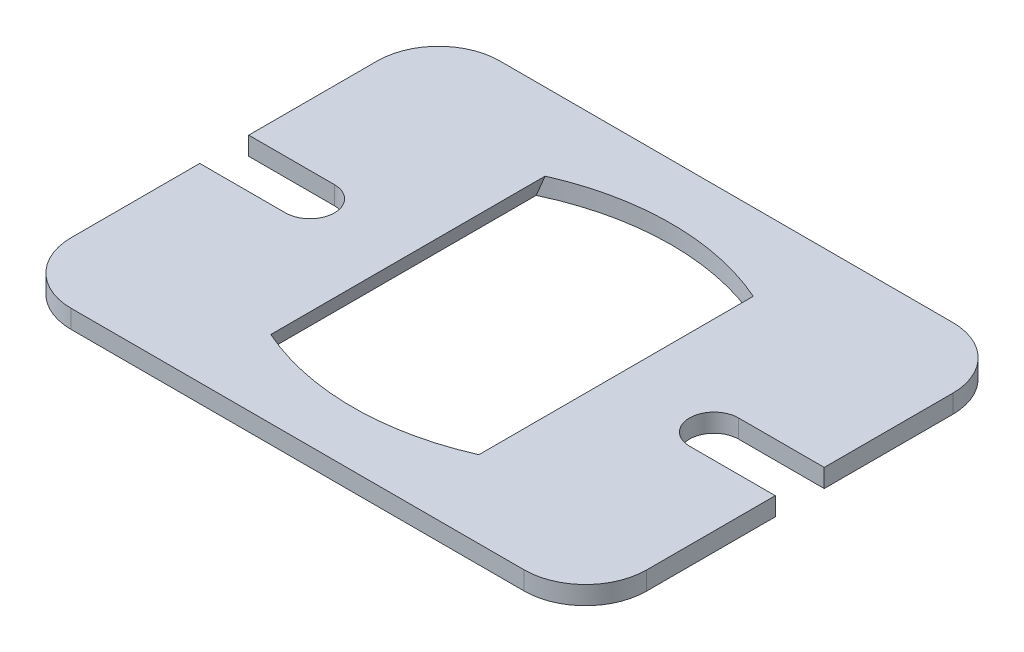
SolidWorks part; units mm, degrees
ref_plane "Front Plane" through (0, 0, 0) normal (0, 0, 1) x (1, 0, 0)
ref_plane "Top Plane" through (0, 0, 0) normal (0, 1, 0) x (1, 0, 0)
ref_plane "Right Plane" through (0, 0, 0) normal (1, 0, 0) x (0, 0, -1)
sketch "Sketch1" plane through (0, 0, 0) normal (0, 1, 0) x (1, 0, 0)
  line L0 (0, 35) -> (94, 35) construction
  line L1 (0, 0) -> (94, 0)
  line L2 (0, 0) -> (0, 31)
  line L3 (0, 70) -> (94, 70)
  line L4 (94, 0) -> (94, 31)
  line L5 (47, 70) -> (47, 0) construction
  line L6 (30, 57.4057) -> (30, 12.5943)
  line L7 (64, 57.4057) -> (64, 12.5943)
  line L8 (64, 70) -> (64, 0) construction
  line L9 (30, 70) -> (30, 0) construction
  line L10 (14, 39) -> (0, 39)
  line L11 (14, 31) -> (0, 31)
  line L12 (80, 39) -> (94, 39)
  line L13 (80, 31) -> (94, 31)
  line L14 (94, 39) -> (94, 70)
  line L15 (0, 39) -> (0, 70)
  arc A0 (30, 12.5943) -> (64, 12.5943) centre (47, 51) ccw
  arc A1 (80, 39) -> (80, 31) centre (80, 35) ccw
  arc A2 (64, 57.4057) -> (30, 57.4057) centre (47, 19) ccw
  arc A3 (14, 31) -> (14, 39) centre (14, 35) ccw
  dimension "D5" = 16
  dimension "D6" = 42
  dimension "D7" = 42
  dimension "D10" = 4
  dimension "D11" = 14
  dimension "D12" = 14
  dimension "D1" = 70
  dimension "D2" = 94
  dimension "D8" = 16
  dimension "D9" = 35
  dimension "D3" = 17
  dimension "D4" = 17
extrude "Extrude1" add sketch "Sketch1" along normal blind 3
chamfer "Chamfer1" distance 3 distance2 1 2 edges at (64, 0, -35) (30, 0, -35)
fillet "Fillet1" radius 10 4 edges at (0, 1.5, -70) (94, 1.5, -70) (94, 1.5, 0) (0, 1.5, 0)
